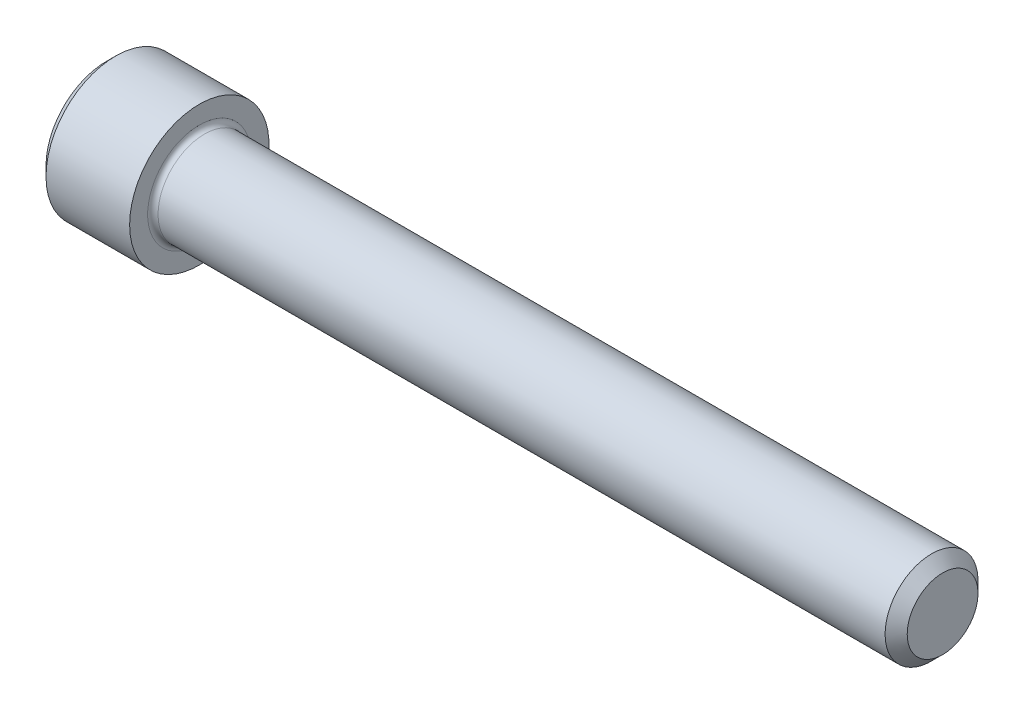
SolidWorks part; units mm, degrees
ref_plane "Plane1" through (0, 0, 0) normal (0, 0, 1) x (1, 0, 0)
ref_plane "Plane2" through (0, 0, 0) normal (0, 1, 0) x (1, 0, 0)
ref_plane "Plane3" through (0, 0, 0) normal (1, 0, 0) x (0, 0, -1)
sketch "BodySke" plane through (0, 0, 0) normal (0, 0, 1) x (1, 0, 0)
  line L0 (0, 0) -> (0, 4.1275)
  line L1 (0.635, 4.7625) -> (6.35, 4.7625)
  line L2 (6.35, 4.7625) -> (6.35, 3.175)
  line L3 (6.35, 3.175) -> (56.3943, 3.175)
  line L4 (57.15, 2.4194) -> (57.15, 0)
  line L5 (57.15, 0) -> (0, 0)
  line L6 (-31.75, 0) -> (127, 0) construction
  line L7 (0, 4.1275) -> (0.635, 4.7625)
  line L8 (57.15, 2.4194) -> (56.3943, 3.175)
  line L9 (0, -4.1275) -> (0.635, -4.7625) construction
  line L10 (57.15, -2.4194) -> (56.3943, -3.175) construction
  line L11 (7.62, 9.525) -> (7.62, 3.175) construction
  line L12 (31.75, 9.525) -> (31.75, 3.175) construction
  line L13 (19.05, 9.525) -> (19.05, 3.175) construction
  dimension "Diameter" = 6.35
  dimension "Head_ht" = 6.35
  dimension "Length" = 50.8
  dimension "Body_ch_ang" = 45
  dimension "Head_dia" = 9.525
  dimension "Head_ch_ang" = 45
  dimension "Head_side_ht" = 5.715
  dimension "Minor_dia" = 4.8387
  dimension "Advance" = 1.27
  dimension "Thread_nom" = 25.4
  dimension "Thread_length" = 38.1
revolve "Base-Revolve" add sketch "BodySke"
fillet "Fillet1" radius 0.3556 1 edges at (6.35, 0, 3.175)
sketch "Sketch2" plane through (0, 0, 0) normal (0, 0, 1) x (1, 0, 0)
  line L0 (0, 2.3812) -> (3.048, 2.3812)
  line L1 (3.048, 2.3812) -> (4.4228, 0)
  line L2 (-31.75, 0) -> (127, 0) construction
  line L3 (4.4228, 0) -> (0, 0)
  line L4 (0, 0) -> (0, 2.3812)
  line L5 (0, 4.1275) -> (0, -4.1275) construction
  line L6 (0, 0) -> (47.625, 0) construction
  line L7 (6.35, -4.7625) -> (6.35, 4.7625) construction
  dimension "D1" = 2.3813
  dimension "D2" = 60
  dimension "Wall_thickness" = 3.302
revolve "Hex-PreBroach" cut sketch "Sketch2" angle 360 about L6
sketch "Sketch3" plane through (0, 0, 0) normal (-1, 0, 0) x (0, 0.5, 0.866)
  line L0 (1.3748, 2.3813) -> (-1.3748, 2.3813)
  line L1 (-1.3748, 2.3813) -> (-2.7496, 0)
  line L2 (1.3748, 2.3813) -> (2.7496, 0)
  line L3 (1.3748, -2.3812) -> (2.7496, 0)
  line L4 (1.3748, -2.3812) -> (-1.3748, -2.3812)
  line L5 (-1.3748, -2.3812) -> (-2.7496, 0)
  dimension "D1" = 2.3813
  dimension "D2" = 2.3813
  dimension "Hex_size" = 4.7625
extrude "Hex" cut sketch "Sketch3" against normal blind 3.048
sketch "Sketch4" plane through (0, 0, 0) normal (-1, 0, 0) x (0, 0, 1)
  line L0 (0, 0) -> (2.8067, 0)
  line L1 (0, 0) -> (6.1484, 3.5498) construction
  line L2 (0, 0) -> (1.4033, 2.4307)
  line L3 (2.3336, 0.614) -> (2.6851, 0.817)
  line L4 (1.6986, 1.7139) -> (2.0501, 1.9169)
  arc A0 (2.3336, 0.614) -> (1.6986, 1.7139) centre (0, 0) ccw
  arc A1 (2.8067, 0) -> (2.6851, 0.817) centre (0, 0) ccw
  arc A2 (1.4033, 2.4307) -> (2.0501, 1.9169) centre (0, 0) cw
  dimension "D1" = 30
  dimension "Spline_n_dim" = 4.826
  dimension "Spline_m_dim" = 5.6134
  dimension "D2" = 60
  dimension "D3" = 0.635
  dimension "Spline_p_dim" = 1.27
extrude "Spline" [suppressed] cut sketch "Sketch4" against normal blind 3.048
pattern_circular "CirPattern1" [suppressed] count 6 every 60
sketch "Sketch5" plane through (0, 0, 0) normal (0, 0, 1) x (1, 0, 0)
  line L0 (-31.75, 0) -> (127, 0) construction
  line L2 (0, 4.1275) -> (0, -4.1275) construction
  circle A0 centre (2.159, 0) radius 0.5905
  dimension "Drilled_hole_dia" = 1.1811
  dimension "Drilled_hole_loc" = 2.159
extrude "Hole" [suppressed] cut sketch "Sketch5" against normal through all and the other way through all
pattern_circular "Drilled-4" [suppressed] count 2 every 60
pattern_circular "Drilled-6" [suppressed] count 3 every 60
sketch "ThdSchSke" plane through (0, 0, 0) normal (0, 0, 1) x (1, 0, 0)
  line L0 (31.75, -2.4194) -> (31.2209, -3.175)
  line L1 (31.75, -2.4194) -> (32.2791, -3.175)
  line L2 (32.2791, -3.175) -> (32.2791, -3.9688)
  line L3 (-3.175, 0) -> (5.1513, 0) construction
  line L5 (32.2791, -3.9688) -> (31.2209, -3.9688)
  line L6 (31.2209, -3.9688) -> (31.2209, -3.175)
  line L7 (0, 4.1275) -> (0, -4.1275) construction
  dimension "Thread_minor" = 4.8387
  dimension "Diameter" = 6.35
  dimension "Start" = 31.75
  dimension "SideAngle" = 55
  dimension "VeeAngle" = 70
  dimension "Overcut" = 7.9375
revolve "ThreadSchematic" [suppressed] cut sketch "ThdSchSke" angle 360 about L3
pattern_linear "ThdSchPat" [suppressed]
equation "\"D2@Sketch3\" = \"Hex_size@Sketch3\" / 2"
equation "\"D1@Sketch3\" = \"Hex_size@Sketch3\" / 2"
equation "\"D1@Sketch2\" = \"Hex_size@Sketch3\" / 2"
equation "\"D3@Sketch4\" = \"Spline_p_dim@Sketch4\" / 2"
equation "\"Thread_minor@ThreadCosmetic\"  =  \"Minor_dia@BodySke\""
equation "\"D2@CirPattern1\" = 360 / \"Num_teeth@CirPattern1\""
equation "\"Wall_thickness@Sketch2\" = \"Head_ht@BodySke\" - \"Key_eng@Hex\""
equation "\"Thread_length@ThreadCosmetic\" = ((sgn( (\"Length@BodySke\" - \"Advance@BodySke\" ) - \"Thread_nom@BodySke\" )-1)*( (\"Length@BodySke\" - \"Advance@BodySke\" ) - \"Thread_nom@BodySke\" ))/-2+ \"Thread_nom@BodySke\""
equation "\"Thread_minor@ThdSchSke\" = \"Minor_dia@BodySke\""
equation "\"Diameter@ThdSchSke\" = \"Diameter@BodySke\""
equation "\"Overcut@ThdSchSke\" = \"Diameter@BodySke\" * 1.25"
equation "\"Start@ThdSchSke\" = \"Head_ht@BodySke\" + \"Length@BodySke\" - \"Thread_length@ThreadCosmetic\"  '---Non-countersunk---"
equation "\"Num_threads@ThdSchPat\" = int( \"Thread_length@ThreadCosmetic\" / \"Advance@BodySke\" + 0.999 )  + 1"
equation "\"Advance@ThdSchPat\" = \"Thread_length@ThreadCosmetic\" /  (\"Num_threads@ThdSchPat\" - 1) 'relax it"
equation "\"Num_threads@ThdSchPat\" = \"Num_threads@ThdSchPat\" - sgn( \"Num_threads@ThdSchPat\" - 1) '---chamfered tips only---"
